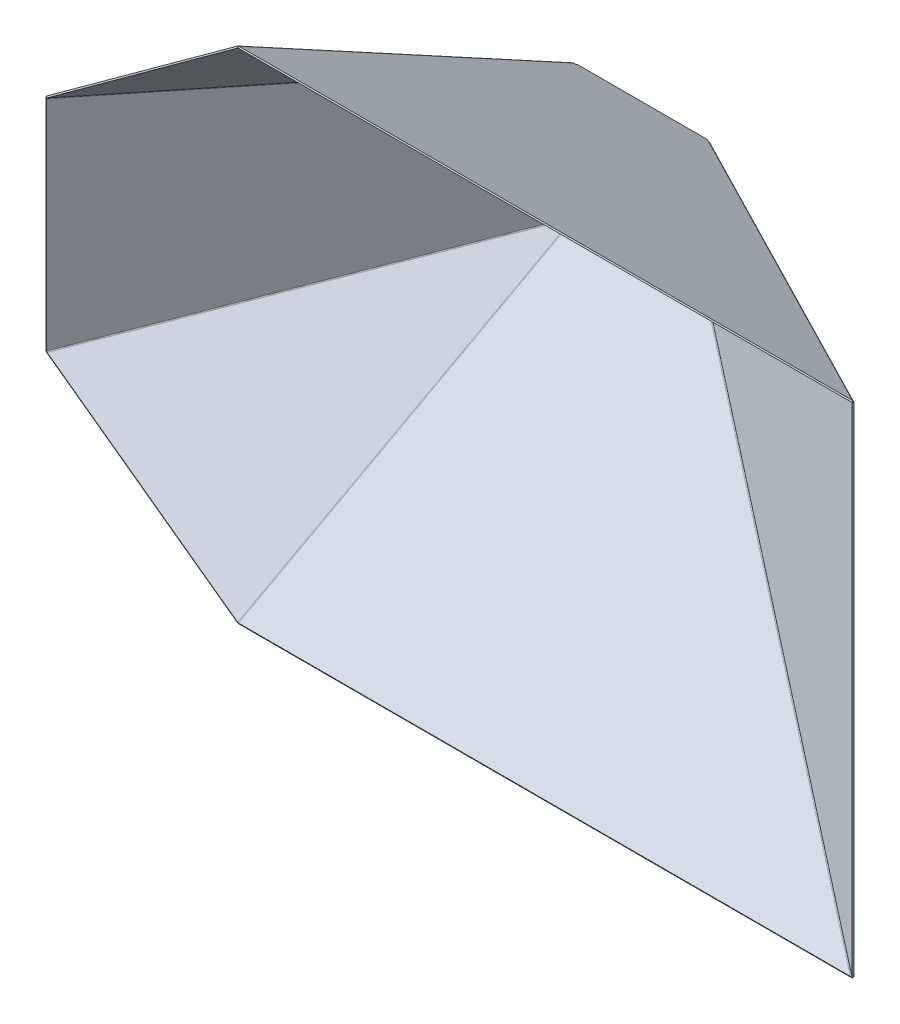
SolidWorks part; units mm, degrees
ref_plane "Ebene vorne" through (0, 0, 0) normal (0, 0, 1) x (1, 0, 0)
ref_plane "Ebene oben" through (0, 0, 0) normal (0, 1, 0) x (1, 0, 0)
ref_plane "Ebene rechts" through (0, 0, 0) normal (1, 0, 0) x (0, 0, -1)
ref_plane "Ebene1" through (0, 0, 230) normal (0, 0, 1) x (1, 0, 0)
sketch "Skizze3" plane through (0, 0, 0) normal (0, 0, 1) x (1, 0, 0)
  line L1 (45, -45) -> (45, 45)
  line L2 (45, 45) -> (-45, 45)
  line L3 (-45, 45) -> (-45, -45)
  line L4 (-45, -45) -> (45, -45)
  circle A0 centre (0, 0) radius 45 construction
  dimension "D1" = 90
sketch "Skizze2" plane through (0, 0, 230) normal (0, 0, 1) x (1, 0, 0)
  line L7 (-175.76, 0) -> (374.24, 0) construction
  line L8 (-175.76, 170) -> (374.24, 170)
  line L9 (-175.76, 170) -> (-175.76, -170)
  line L10 (-175.76, -170) -> (374.24, -170)
  line L11 (374.24, 170) -> (374.24, -170)
  dimension "D12" = 340
  dimension "D14" = 550
  dimension "D15" = 374.24
loft "Ausformung3" add profiles "Skizze3", "Skizze2"
sketch "Skizze4" plane through (0, 0, 230) normal (0, 0, 1) x (1, 0, 0)
  line L0 (-45.0037, -170) -> (-175.76, -75)
  line L1 (-175.76, -170) -> (374.24, -170) construction
  line L2 (-175.76, 170) -> (-175.76, -170) construction
  dimension "D1" = 75
  dimension "D2" = 36
ref_plane "Ebene2" through (-30.9603, -42.6133, -23.1599) normal (0.5381, 0.7406, 0.4025) x (-0.8429, 0.4728, 0.2569)
sketch "Skizze7" plane through (-30.9603, -42.6133, -23.1599) normal (0.5381, 0.7406, 0.4025) x (-0.8429, 0.4728, 0.2569)
  line L0 (171.7874, 237.8967) -> (16.6564, 21.4885)
  line L1 (171.7874, 237.8967) -> (16.6564, 21.4885)
  line L2 (16.6608, 283.2613) -> (16.6564, 21.4885)
  line L3 (16.6608, 283.2613) -> (16.6564, 21.4885)
  line L4 (171.7874, 237.8967) -> (16.6608, 283.2613)
  line L5 (171.7874, 237.8967) -> (16.6608, 283.2613)
  point P0 (247.3329, 1284.2173)
extrude "Schnitt-Linear austragen1" cut sketch "Skizze7" against normal through all draft 45
mirror "Spiegeln1" about plane through (0, 0, 0) normal (0, 1, 0) of "Schnitt-Linear austragen1"
shell "Wandung1" thickness 1
rip "Schlitz1"
sheet metal parameters "Blech2" parameters "D1"=1, "Dicke"=1
bend "Biegung-Winkel6" bend angle 66.955 parameters "D1"=0, "D5"=1
flatten bends "Abwickeln2" parameters "D1"=0
sketch "Skizze-Winkel2" plane through (14.7583, 0, -21.1262) normal (-0.5727, 0, 0.8198) x (0.8198, 0, 0.5727)
  line L0 (36.8261, -45.2054) -> (438.4466, -170.2054) construction
  line L1 (-46.6667, -79.5662) -> (47.3851, -322.064) construction
  line L2 (-47.9803, -79.5811) -> (-113.951, -335.8686) construction
  line L3 (-132.7392, -47.2076) -> (-254.4185, -282.2173) construction
  line L4 (-133.7084, -46.3208) -> (-365.472, -164.374) construction
bend "Biegung-Winkel2" bend angle 48.188 parameters "D1"=0, "D5"=4
bend "Biegung-Winkel3" bend angle 32.552 parameters "D1"=0, "D5"=5
bend "Biegung-Winkel4" bend angle 32.552 parameters "D1"=0, "D5"=2
bend "Biegung-Winkel5" bend angle 48.188 parameters "D1"=0, "D5"=3
process bends "Abbiegen2" parameters "D1"=0
sketch "Abwicklung-Skizze2" plane through (14.7583, 0, -21.1262) normal (-0.5727, 0, 0.8198) x (0.8198, 0, 0.5727)
flat pattern "Abwicklung2"
sketch "Biegung-Linien2" plane through (14.7583, 0, -21.1262) normal (-0.5727, 0, 0.8198) x (0.8198, 0, 0.5727)
  line L0 (-365.472, -164.374) -> (-133.7084, -46.3208) construction
  line L1 (-254.4281, -282.2358) -> (-132.7392, -47.2076) construction
  line L2 (-113.9562, -335.8888) -> (-47.9803, -79.5811) construction
  line L3 (47.3851, -322.064) -> (-46.6667, -79.5662) construction
  line L4 (438.5105, -170.2253) -> (37.9183, -45.5453) construction
  line L5 (-365.472, -164.374) -> (-133.7084, -46.3208) construction
  line L6 (-254.4281, -282.2358) -> (-132.7392, -47.2076) construction
  line L7 (-113.9562, -335.8888) -> (-47.9803, -79.5811) construction
  line L8 (47.3851, -322.064) -> (-46.6667, -79.5662) construction
  line L9 (438.5105, -170.2253) -> (37.9183, -45.5453) construction
bend of the flat pattern "Abwickeln-<Biegung-Winkel2>1"
bend of the flat pattern "Abwickeln-<Biegung-Winkel3>1"
bend of the flat pattern "Abwickeln-<Biegung-Winkel4>1"
bend of the flat pattern "Abwickeln-<Biegung-Winkel5>1"
bend of the flat pattern "Abwickeln-<Biegung-Winkel6>1"
